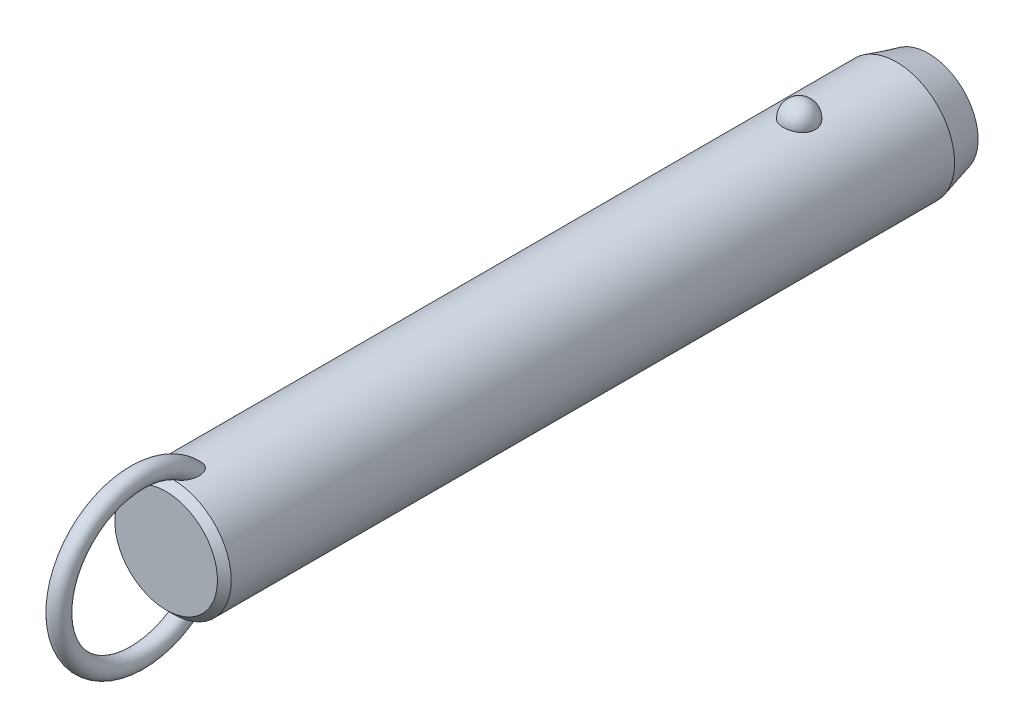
SolidWorks part; units mm, degrees
ref_plane "Front Plane" through (0, 0, 0) normal (0, 0, 1) x (1, 0, 0)
ref_plane "Top Plane" through (0, 0, 0) normal (0, 1, 0) x (1, 0, 0)
ref_plane "Right Plane" through (0, 0, 0) normal (1, 0, 0) x (0, 0, -1)
sketch "Sketch2" plane through (0, 0, 0) normal (0, 0, 1) x (1, 0, 0)
  circle A0 centre (0, 0) radius 12.7
  point P3 (0, 12.7)
  dimension "D1" = 25.4
extrude "Boss-Extrude1" add sketch "Sketch2" along normal blind 121.9
sketch "Sketch3" plane through (0, 0, 0) normal (0, 0, -1) x (-1, 0, 0)
  circle A0 centre (0, 0) radius 12.7
  dimension "D1" = 25.4
extrude "Boss-Extrude2" add sketch "Sketch3" along normal blind 31.7
chamfer "Chamfer1" distance 7 angle 15 1 edges at (-12.7, 0, -31.7)
sketch "Sketch12" plane through (0, 0, 0) normal (1, 0, 0) x (0, 0, -1)
  line L0 (-121.9, 12.7) -> (-121.9, -12.7) construction
  point P0 (-121.9, 0)
sketch "Sketch13" plane through (0, 0, 0) normal (1, 0, 0) x (0, 0, -1)
  circle A0 centre (-140.95, 0) radius 19.05
  point P2 (-121.9, 0)
  dimension "D1" = 38.1
sketch "Sketch14" plane through (0, 0, 0) normal (0, 1, 0) x (1, 0, 0)
  circle A0 centre (0, -123.9) radius 2
  point P2 (0, -121.9)
  dimension "D1" = 4
sweep "Sweep1" add profiles "Sketch14" path "Sketch13"
sketch "Sketch15" plane through (0, 0, 121.9) normal (0, 0, 1) x (1, 0, 0)
  circle A0 centre (0, 0) radius 12.7
  dimension "D1" = 25.4
extrude "Boss-Extrude3" add sketch "Sketch15" along normal blind 12.7
chamfer "Chamfer2" distance 1.5 angle 45 1 edges at (12.7, 0, 134.6)
sketch "Sketch18" plane through (0, 0, 0) normal (1, 0, 0) x (0, 0, -1)
  line L0 (24.7, 12.7) -> (-126.751, 12.7) construction
  line L1 (3.5, 16.2) -> (3.5, 9.2)
  line L2 (-126.751, -12.7) -> (24.7, -12.7) construction
  arc A0 (3.5, 16.2) -> (3.5, 9.2) centre (3.5, 12.7) ccw
  point P4 (0, 12.7)
  dimension "D1" = 28.9
revolve "Revolve1" add sketch "Sketch18" angle 360 about L1
